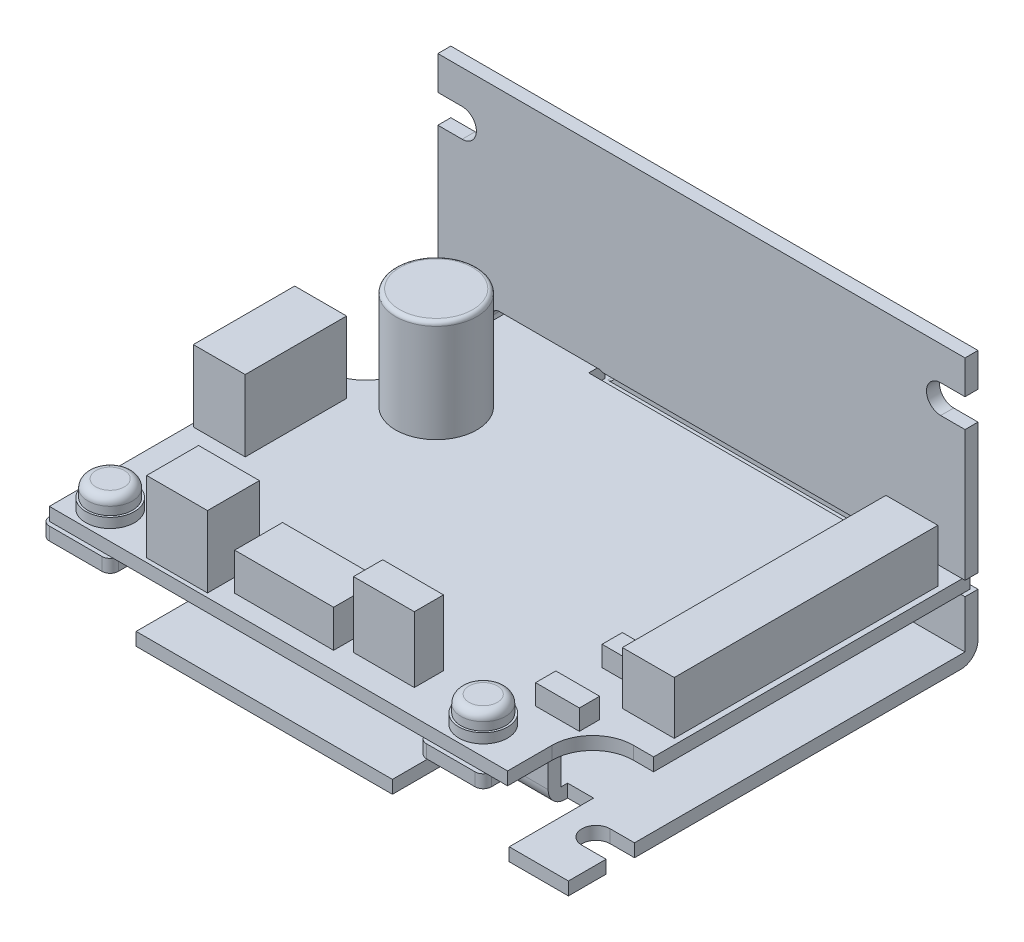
SolidWorks part; units mm, degrees
ref_plane "Front" through (0, 0, 0) normal (0, 0, 1) x (1, 0, 0)
ref_plane "Top" through (0, 0, 0) normal (0, 1, 0) x (1, 0, 0)
ref_plane "Right" through (0, 0, 0) normal (1, 0, 0) x (0, 0, -1)
sketch "Sketch1" plane through (0, 0, 0) normal (0, 1, 0) x (1, 0, 0)
  line L0 (-55, 0) -> (55, 0) construction
  line L1 (-4.5, -4) -> (60.5, -4)
  line L2 (-4.5, -4) -> (-4.5, 31.65)
  line L3 (-4.5, 46.5) -> (60.5, 46.5)
  line L4 (60.5, -4) -> (60.5, 0.65)
  line L5 (0, -55) -> (0, 55) construction
  line L6 (-1.5, 31.65) -> (-4.5, 31.65)
  line L7 (-1.5, 35.15) -> (-4.5, 35.15)
  line L8 (57.5, 0.65) -> (60.5, 0.65)
  line L9 (57.5, 4.15) -> (60.5, 4.15)
  line L10 (60.5, 4.15) -> (60.5, 46.5)
  line L11 (-4.5, 35.15) -> (-4.5, 46.5)
  circle A0 centre (0, 0) radius 1.5
  arc A1 (-1.5, 31.65) -> (-1.5, 35.15) centre (-1.5, 33.4) ccw
  arc A2 (57.5, 4.15) -> (57.5, 0.65) centre (57.5, 2.4) ccw
  dimension "D5" = 3
  dimension "D6" = 37.4
  dimension "D7" = 3.5
  dimension "D9" = 3.5
  dimension "D1" = 4
  dimension "D2" = 50.5
  dimension "D3" = 65
  dimension "D4" = 4.5
  dimension "D8" = 62
  dimension "D10" = 3
  dimension "D11" = 6.4
extrude "Extrude1" add sketch "Sketch1" against normal blind 1.6
sketch "Sketch2" plane through (0, 0, 0) normal (0, 1, 0) x (1, 0, 0)
  line L0 (60.5, 4.15) -> (60.5, 46.5) construction
  line L1 (-4.5, 46.5) -> (60.5, 46.5)
  line L2 (-4.5, 46.5) -> (-4.5, 44.9)
  line L3 (-4.5, 44.9) -> (60.5, 44.9)
  line L4 (60.5, 46.5) -> (60.5, 44.9)
  dimension "D1" = 1.6
extrude "Extrude2" add sketch "Sketch2" along normal blind 31.4
sketch "Sketch3" plane through (0, 0, -44.9) normal (0, 0, 1) x (1, 0, 0)
  line L0 (60.5, 31.4) -> (60.5, 0) construction
  line L1 (46.5, 7.65) -> (60.5, 7.65)
  line L2 (46.5, 7.65) -> (46.5, 5.9)
  line L3 (46.5, 5.9) -> (60.5, 5.9)
  line L4 (60.5, 7.65) -> (60.5, 5.9)
  line L5 (27.775, 0) -> (-27.775, 0) construction
  line L6 (16.2, 7.65) -> (2.2, 7.65)
  line L7 (16.2, 7.65) -> (16.2, 5.9)
  line L8 (16.2, 5.9) -> (2.2, 5.9)
  line L9 (2.2, 7.65) -> (2.2, 5.9)
  dimension "D1" = 14
  dimension "D2" = 44.3
  dimension "D3" = 14
  dimension "D4" = 5.9
  dimension "D5" = 1.75
  dimension "D6" = 5.9
  dimension "D7" = 1.75
extrude "Extrude3" cut sketch "Sketch3" against normal through all
sketch "Sketch4" plane through (0, 0, -44.9) normal (0, 0, 1) x (1, 0, 0)
  line L0 (60.5, 31.4) -> (60.5, 7.65) construction
  line L1 (27.775, 0) -> (-27.775, 0) construction
  line L2 (57.5, 27.25) -> (60.5, 27.25)
  line L3 (57.5, 23.75) -> (60.5, 23.75)
  line L4 (60.5, 27.25) -> (60.5, 23.75)
  arc A0 (57.5, 27.25) -> (57.5, 23.75) centre (57.5, 25.5) ccw
  dimension "D1" = 3.5
  dimension "D2" = 3
  dimension "D3" = 25.5
extrude "Extrude4" cut sketch "Sketch4" against normal through all
ref_plane "Plane1" through (28, 0, 0) normal (1, 0, 0) x (0, 0, -1)
mirror "Mirror1" about plane through (28, 0, 0) normal (1, 0, 0) of "Extrude4"
sketch "Sketch5" plane through (0, 0, 0) normal (0, 1, 0) x (1, 0, 0)
  line L0 (53.2, -4) -> (53.2, 6.4)
  line L1 (-4.5, -4) -> (60.5, -4) construction
  line L2 (53.2, 6.4) -> (50, 6.4)
  line L3 (50, 6.4) -> (50, 4)
  line L4 (50, 4) -> (42, 4)
  line L5 (42, 4) -> (42, 6.4)
  line L6 (42, 6.4) -> (38.8, 6.4)
  line L7 (38.8, 6.4) -> (38.8, -4)
  line L8 (38.8, -4) -> (53.2, -4)
  line L9 (60.5, -4) -> (60.5, 0.65) construction
  dimension "D1" = 3.2
  dimension "D2" = 3.2
  dimension "D3" = 21.7
  dimension "D4" = 2.4
  dimension "D5" = 2.4
  dimension "D6" = 8
  dimension "D7" = 8
extrude "Extrude5" cut sketch "Sketch5" against normal through all
sketch "Sketch6" plane through (0, 0, 0) normal (0, 1, 0) x (1, 0, 0)
  line L0 (50, 6.4) -> (50, 4) construction
  line L1 (42, 4) -> (50, 4)
  line L2 (42, 4) -> (42, 5.6)
  line L3 (42, 5.6) -> (50, 5.6)
  line L4 (50, 4) -> (50, 5.6)
  dimension "D1" = 1.6
extrude "Extrude6" add sketch "Sketch6" along normal blind 5.9
sketch "Sketch7" plane through (0, 0, -4) normal (0, 0, 1) x (1, 0, 0)
  line L0 (50, -1.6) -> (50, 5.9) construction
  line L1 (42, 5.9) -> (50, 5.9)
  line L2 (42, 5.9) -> (42, 4.3)
  line L3 (42, 4.3) -> (50, 4.3)
  line L4 (50, 5.9) -> (50, 4.3)
  dimension "D1" = 1.6
extrude "Extrude7" add sketch "Sketch7" along normal blind 8
fillet "Fillet1" radius 1 2 edges at (42, 5.1, 4) (50, 5.1, 4)
fillet "Fillet2" radius 2.1 2 edges at (46, -1.6, -4) (46, 5.9, -5.6)
sketch "Sketch13" plane through (0, 0, 0) normal (0, 1, 0) x (1, 0, 0)
  line L0 (7.2, -4) -> (7.2, 6.4)
  line L1 (-4.5, -4) -> (38.8, -4) construction
  line L2 (7.2, 6.4) -> (4, 6.4)
  line L3 (4, 6.4) -> (4, 4)
  line L4 (4, 4) -> (-4.5, 4)
  line L5 (-4.5, 31.65) -> (-4.5, -4) construction
  line L6 (-4.5, 4) -> (-4.5, -4)
  line L7 (-4.5, -4) -> (7.2, -4)
  dimension "D1" = 2.4
  dimension "D2" = 3.2
  dimension "D3" = 8.5
  dimension "D4" = 8
extrude "Extrude9" cut sketch "Sketch13" against normal through all
sketch "Sketch14" plane through (0, 0, 0) normal (0, 1, 0) x (1, 0, 0)
  line L0 (-4.5, 31.65) -> (-4.5, 4) construction
  line L1 (4, 4) -> (-4.5, 4)
  line L2 (4, 4) -> (4, 5.6)
  line L3 (4, 5.6) -> (-4.5, 5.6)
  line L4 (-4.5, 4) -> (-4.5, 5.6)
  dimension "D1" = 1.6
extrude "Extrude10" add sketch "Sketch14" along normal blind 5.9
sketch "Sketch15" plane through (0, 0, -4) normal (0, 0, 1) x (1, 0, 0)
  line L0 (4, -1.6) -> (4, 5.9) construction
  line L1 (-4.5, 5.9) -> (4, 5.9)
  line L2 (-4.5, 5.9) -> (-4.5, 4.3)
  line L3 (-4.5, 4.3) -> (4, 4.3)
  line L4 (4, 5.9) -> (4, 4.3)
  dimension "D1" = 1.6
extrude "Extrude11" add sketch "Sketch15" along normal blind 8
fillet "Fillet3" radius 1 2 edges at (4, 5.1, 4) (-4.5, 5.1, 4)
fillet "Fillet4" radius 2.1 2 edges at (-0.25, -1.6, -4) (-0.25, 5.9, -5.6)
fillet "Fillet5" radius 0.875 6 edges at (46.5, 7.65, -45.7) (46.5, 5.9, -45.7) (2.2, 7.65, -45.7) (16.2, 7.65, -45.7) (16.2, 5.9, -45.7) (2.2, 5.9, -45.7)
fillet "Fillet7" radius 2.1 1 edges at (28, -1.6, -46.5)
sketch "Sketch16" plane through (0, 5.9, 0) normal (0, 1, 0) x (1, 0, 0)
  line L0 (3.5, 46) -> (3.5, 33)
  line L1 (-4, -3.5) -> (60, -3.5)
  line L2 (-4, -3.5) -> (-4, 46)
  line L3 (-4, 46) -> (60, 46)
  line L4 (60, -3.5) -> (60, 46)
  line L5 (-1.5, 28) -> (-4, 28)
  line L6 (52.5, -3.5) -> (52.5, 2)
  line L7 (57.5, 7) -> (60, 7)
  line L8 (60.5, 46.5) -> (-4.5, 46.5) construction
  line L9 (60.5, 44.4) -> (60.5, 46.5) construction
  circle A0 centre (0, 0) radius 1.75
  circle A1 centre (46, 0) radius 1.6
  circle A2 centre (7.5, 41) radius 1.75
  circle A3 centre (48, 41) radius 1.75
  arc A5 (57.5, 7) -> (52.5, 2) centre (57.5, 2) ccw
  arc A6 (3.5, 33) -> (-1.5, 28) centre (-1.5, 33) cw
  dimension "D7" = 3.2
  dimension "D8" = 3.5
  dimension "D9" = 3.5
  dimension "D10" = 3.5
  dimension "D17" = 5
  dimension "D18" = 5
  dimension "D1" = 49.5
  dimension "D2" = 64
  dimension "D3" = 3.5
  dimension "D4" = 60
  dimension "D5" = 5
  dimension "D6" = 31.5
  dimension "D11" = 56.5
  dimension "D12" = 40.5
  dimension "D13" = 12
  dimension "D14" = 46
  dimension "D15" = 7.5
  dimension "D16" = 10.5
  dimension "D19" = 0.5
  dimension "D20" = 0.5
extrude "Extrude13" add sketch "Sketch16" along normal blind 1.6 separate body contours L0 A6 L5 L2 L1 L6 A5 L7 L4 L3 A1 A2 A3 M3 M2 M7 | L2 L1 A0 M7 M2 M3 | A2 | A3
sketch "Sketch17" plane through (0, 7.5, 0) normal (0, 1, 0) x (1, 0, 0)
  line L0 (60, 7) -> (60, 46) construction
  line L1 (15, 46) -> (48, 46)
  line L2 (15, 46) -> (15, 44)
  line L3 (15, 44) -> (48, 44)
  line L4 (48, 46) -> (48, 44)
  line L5 (3.5, 46) -> (60, 46) construction
  dimension "D1" = 12
  dimension "D2" = 33
  dimension "D3" = 2
extrude "Extrude14" cut sketch "Sketch17" against normal blind 1.6
sketch "Sketch18" plane through (0, 7.5, 0) normal (0, 1, 0) x (1, 0, 0)
  line L1 (52.9, 42.75) -> (59.3, 42.75)
  line L2 (52.9, 42.75) -> (52.9, 10.25)
  line L3 (52.9, 10.25) -> (59.3, 10.25)
  line L4 (59.3, 42.75) -> (59.3, 10.25)
  line L5 (60.5, -4) -> (60.5, 0.65) construction
  line L6 (53.2, -4) -> (60.5, -4) construction
  dimension "D1" = 32.5
  dimension "D2" = 14.25
  dimension "D3" = 1.2
  dimension "D4" = 6.4
extrude "Extrude15" add sketch "Sketch18" along normal blind 6.5
sketch "Sketch19" plane through (0, 7.5, 0) normal (0, 1, 0) x (1, 0, 0)
  line L1 (47.3, 7.65) -> (52.7, 7.65)
  line L2 (47.3, 7.65) -> (47.3, 5.15)
  line L3 (47.3, 5.15) -> (52.7, 5.15)
  line L4 (52.7, 7.65) -> (52.7, 5.15)
  line L5 (47.3, 7.65) -> (52.7, 5.15) construction
  line L6 (47.3, 5.15) -> (52.7, 7.65) construction
  line L7 (47.3, 15.85) -> (52.7, 15.85)
  line L8 (47.3, 15.85) -> (47.3, 13.35)
  line L9 (47.3, 13.35) -> (52.7, 13.35)
  line L10 (52.7, 15.85) -> (52.7, 13.35)
  line L11 (47.3, 15.85) -> (52.7, 13.35) construction
  line L12 (47.3, 13.35) -> (52.7, 15.85) construction
  line L13 (60.5, -4) -> (60.5, 0.65) construction
  line L14 (49, -4) -> (43, -4) construction
  line L15 (53.2, -4) -> (60.5, -4) construction
  point P0 (50, 6.4)
  point P5 (50, 14.6)
  dimension "D1" = 5.4
  dimension "D2" = 2.5
  dimension "D3" = 5.4
  dimension "D4" = 2.5
  dimension "D5" = 9.15
  dimension "D6" = 7.8
  dimension "D7" = 17.35
extrude "Extrude16" add sketch "Sketch19" along normal blind 2.5
sketch "Sketch20" plane through (0, 7.5, 0) normal (0, 1, 0) x (1, 0, 0)
  line L1 (30.35, 3.25) -> (37.85, 3.25)
  line L2 (30.35, 3.25) -> (30.35, -0.35)
  line L3 (30.35, -0.35) -> (37.85, -0.35)
  line L4 (37.85, 3.25) -> (37.85, -0.35)
  line L5 (30.35, 3.25) -> (37.85, -0.35) construction
  line L6 (30.35, -0.35) -> (37.85, 3.25) construction
  line L7 (60.5, -4) -> (60.5, 0.65) construction
  line L8 (53.2, -4) -> (60.5, -4) construction
  point P0 (34.1, 1.45)
  dimension "D1" = 7.5
  dimension "D2" = 3.6
  dimension "D3" = 3.65
  dimension "D4" = 22.65
extrude "Extrude17" add sketch "Sketch20" along normal blind 8.1
sketch "Sketch21" plane through (0, 7.5, 0) normal (0, 1, 0) x (1, 0, 0)
  line L1 (16.7, 4.55) -> (28.9, 4.55)
  line L2 (16.7, 4.55) -> (16.7, -1.35)
  line L3 (16.7, -1.35) -> (28.9, -1.35)
  line L4 (28.9, 4.55) -> (28.9, -1.35)
  line L5 (16.7, 4.55) -> (28.9, -1.35) construction
  line L6 (16.7, -1.35) -> (28.9, 4.55) construction
  line L7 (60.5, -4) -> (60.5, 0.65) construction
  line L8 (7.2, -4) -> (38.8, -4) construction
  point P0 (22.8, 1.6)
  dimension "D1" = 12.2
  dimension "D2" = 5.9
  dimension "D3" = 2.65
  dimension "D4" = 31.6
extrude "Extrude18" add sketch "Sketch21" along normal blind 4.6
sketch "Sketch22" plane through (0, 7.5, 0) normal (0, 1, 0) x (1, 0, 0)
  line L1 (7.5, 3.4) -> (15, 3.4)
  line L2 (7.5, 3.4) -> (7.5, -3)
  line L3 (7.5, -3) -> (15, -3)
  line L4 (15, 3.4) -> (15, -3)
  line L5 (7.5, 3.4) -> (15, -3) construction
  line L6 (7.5, -3) -> (15, 3.4) construction
  line L7 (60.5, -4) -> (60.5, 0.65) construction
  line L8 (7.2, -4) -> (38.8, -4) construction
  point P0 (11.25, 0.2)
  dimension "D1" = 7.5
  dimension "D2" = 6.4
  dimension "D3" = 1
  dimension "D4" = 45.5
extrude "Extrude19" add sketch "Sketch22" along normal blind 8.8
sketch "Sketch23" plane through (0, 7.5, 0) normal (0, 1, 0) x (1, 0, 0)
  line L0 (3, -4) -> (-3.5, -4) construction
  line L1 (-3.6, 26.35) -> (2.8, 26.35)
  line L2 (-3.6, 26.35) -> (-3.6, 13.85)
  line L3 (-3.6, 13.85) -> (2.8, 13.85)
  line L4 (2.8, 26.35) -> (2.8, 13.85)
  line L5 (60.5, -4) -> (60.5, 0.65) construction
  dimension "D1" = 17.85
  dimension "D2" = 57.7
  dimension "D3" = 6.4
  dimension "D4" = 12.5
extrude "Extrude20" add sketch "Sketch23" along normal blind 8.8
sketch "Sketch24" plane through (0, 7.5, 0) normal (0, 1, 0) x (1, 0, 0)
  line L0 (3, -4) -> (-3.5, -4) construction
  line L1 (60.5, -4) -> (60.5, 0.65) construction
  circle A0 centre (9.2, 31) radius 5
  dimension "D1" = 10
  dimension "D2" = 35
  dimension "D3" = 51.3
extrude "Extrude21" add sketch "Sketch24" along normal blind 12.6
sketch "Sketch25" plane through (0, 7.5, 0) normal (0, 1, 0) x (1, 0, 0)
  circle A0 centre (0, 0) radius 1.5
  circle A1 centre (46, 0) radius 1.5
  dimension "D1" = 3
  dimension "D2" = 3
extrude "Extrude22" add sketch "Sketch25" against normal blind 4.8 separate body
sketch "Sketch26" plane through (0, 7.5, 0) normal (0, 1, 0) x (1, 0, 0)
  circle A0 centre (0, 0) radius 3
  circle A1 centre (46, 0) radius 3
  dimension "D1" = 6
  dimension "D2" = 6
extrude "Extrude23" add sketch "Sketch26" along normal blind 1.2 separate body
sketch "Sketch27" plane through (0, 8.7, 0) normal (0, 1, 0) x (1, 0, 0)
  circle A0 centre (0, 0) radius 2.75
  circle A1 centre (46, 0) radius 2.75
  dimension "D1" = 5.5
  dimension "D2" = 5.5
extrude "Extrude24" add sketch "Sketch27" along normal blind 2
fillet "Fillet9" radius 1 2 edges at (46, 10.7, 2.75) (0, 10.7, 2.75)
fillet "Fillet10" radius 0.5 1 edges at (9.2, 20.1, -26)
